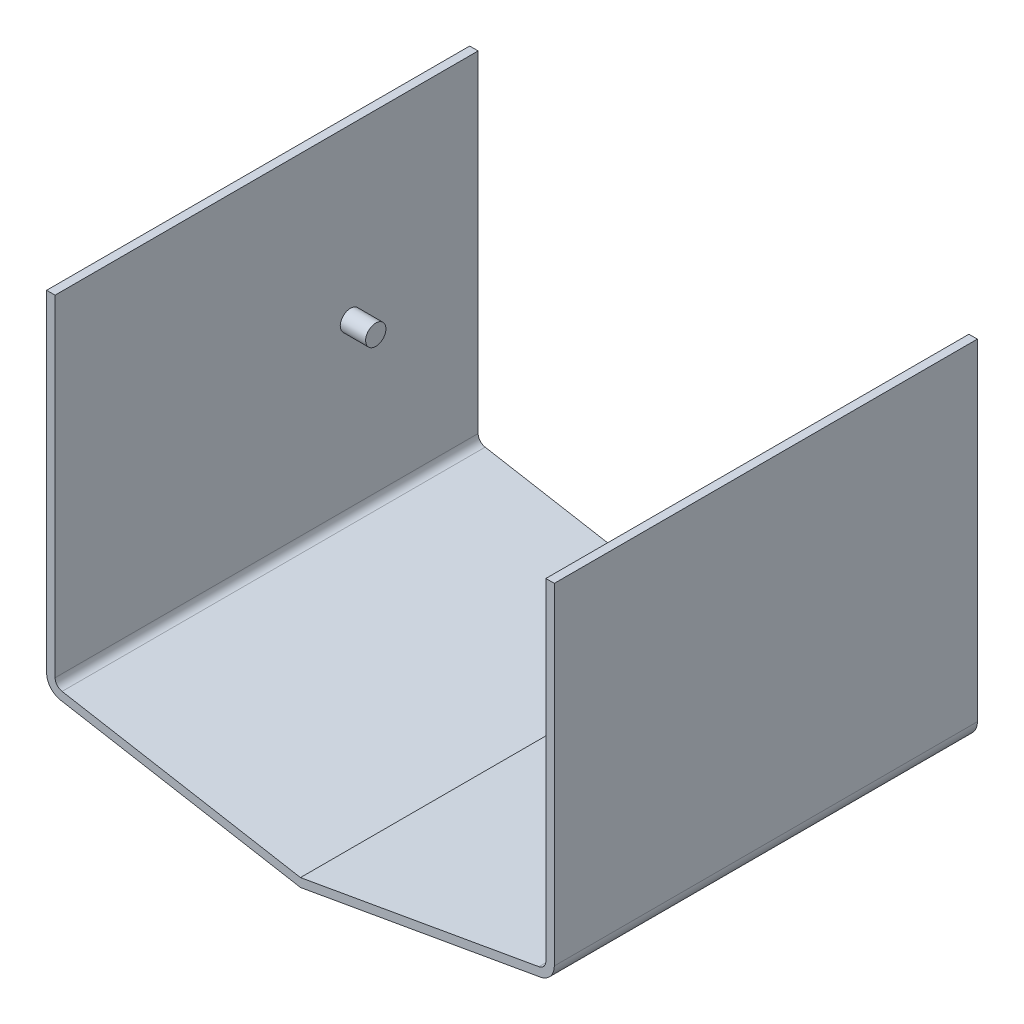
SolidWorks part; units mm, degrees
ref_plane "Face" through (0, 0, 0) normal (0, 0, 1) x (1, 0, 0)
ref_plane "Dessus" through (0, 0, 0) normal (0, 1, 0) x (1, 0, 0)
ref_plane "Droite" through (0, 0, 0) normal (1, 0, 0) x (0, 0, -1)
sketch "Esquisse1" plane through (0, 0, 0) normal (0, 0, 1) x (1, 0, 0)
  line L0 (-290, 0) -> (-290, -391.609)
  line L1 (-281.7365, -401.4571) -> (0, -451.1348)
  line L2 (0, -451.1348) -> (281.7365, -401.4571)
  line L3 (290, -391.609) -> (290, 0)
  line L4 (290, 0) -> (300, 0)
  line L5 (300, 0) -> (300, -391.609)
  line L6 (283.473, -411.3052) -> (0, -461.2891)
  line L7 (0, -461.2891) -> (-283.473, -411.3052)
  line L9 (-290, 0) -> (-300, 0)
  line L10 (-300, 0) -> (-300, -391.609)
  arc A0 (281.7365, -401.4571) -> (290, -391.609) centre (280, -391.609) ccw
  arc A1 (-290, -391.609) -> (-281.7365, -401.4571) centre (-280, -391.609) ccw
  arc A2 (-300, -391.609) -> (-283.473, -411.3052) centre (-280, -391.609) ccw
  arc A3 (300, -391.609) -> (283.473, -411.3052) centre (280, -391.609) cw
  point P13 (290, -400)
  point P16 (-290, -400)
  point P21 (300, -408.391)
  dimension "D12" = 10
  dimension "D13" = 20
  dimension "D1" = 100
  dimension "D2" = 100
  dimension "D3" = 600
  dimension "D4" = 10
  dimension "D5" = 400
  dimension "D6" = 10
  dimension "D7" = 10
  dimension "D8" = 10
  dimension "D9" = 400
  dimension "D10" = 300
  dimension "D11" = 300
extrude "Base-Extrusion" add sketch "Esquisse1" along normal blind 500
sketch "Esquisse2" plane through (-290, 0, 0) normal (1, 0, 0) x (0, 0, -1)
  line L0 (0, -391.609) -> (0, 0) construction
  line L2 (-500, 0) -> (0, 0) construction
  circle A0 centre (-151, -200) radius 12
  dimension "D3" = 24
  dimension "D1" = 151
  dimension "D2" = 200
extrude "Boss.-Extru.1" add sketch "Esquisse2" along normal blind 30
mirror "Symétrie1" about plane through (0, 0, 0) normal (1, 0, 0)
